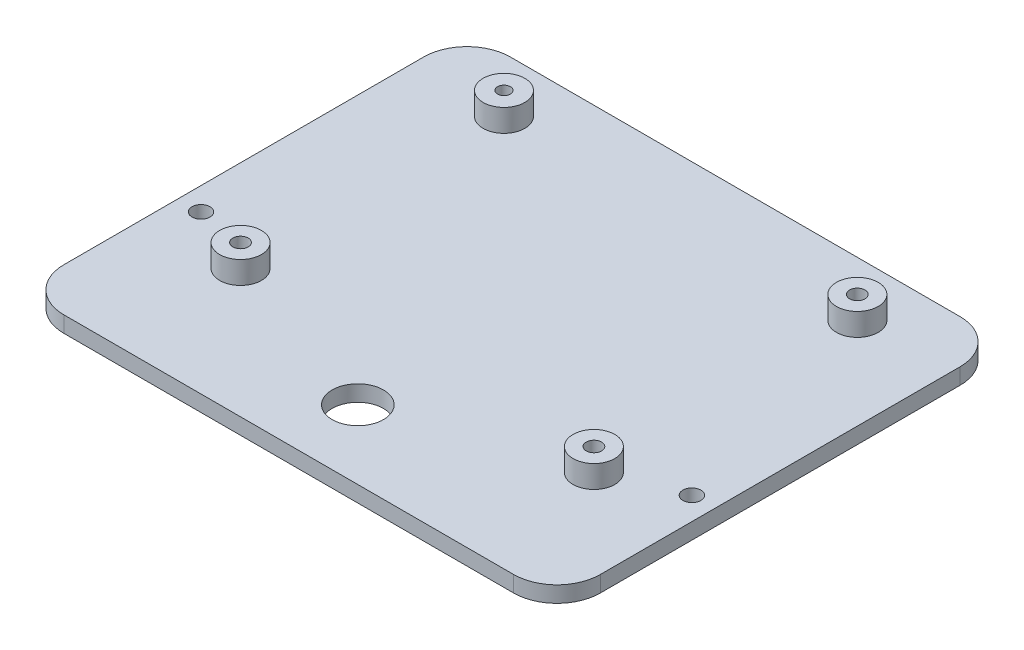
SolidWorks part; units mm, degrees
ref_plane "Front Plane" through (0, 0, 0) normal (0, 0, 1) x (1, 0, 0)
ref_plane "Top Plane" through (0, 0, 0) normal (0, 1, 0) x (1, 0, 0)
ref_plane "Right Plane" through (0, 0, 0) normal (1, 0, 0) x (0, 0, -1)
sketch "Sketch1" plane through (0, 0, 0) normal (0, 1, 0) x (1, 0, 0)
  line L0 (0, 12) -> (0, 13) construction
  line L1 (-32.5, -8.5) -> (32.5, -8.5)
  line L2 (-32.5, -8.5) -> (-32.5, 8.5)
  line L3 (-32.5, 8.5) -> (32.5, 8.5)
  line L4 (32.5, -8.5) -> (32.5, 8.5)
  line L5 (-32.5, -8.5) -> (32.5, 8.5) construction
  line L6 (-32.5, 8.5) -> (32.5, -8.5) construction
  line L15 (0, -12) -> (0, -17.3) construction
  line L21 (-39.5, 18.7) -> (40.5, 18.7)
  line L22 (-39.5, 18.7) -> (-39.5, -17.3)
  line L23 (-39.5, -17.3) -> (40.5, -17.3)
  line L24 (40.5, 18.7) -> (40.5, -17.3)
  line L29 (-36.5, -13) -> (36.5, 13) construction
  line L30 (-36.5, 13) -> (36.5, -13) construction
  point P0 (0, 0)
  point P6 (0, 0)
  point P23 (0, 0)
extrude "Boss-Extrude2" add sketch "Sketch1" along normal blind 2
sketch "Sketch2" plane through (0, 2, 0) normal (0, 1, 0) x (1, 0, 0)
  line L0 (36.5, 0) -> (38, 0) construction
  line L1 (-36.5, -13) -> (36.5, -13)
  line L2 (-36.5, -13) -> (-36.5, 13)
  line L3 (-36.5, 13) -> (36.5, 13)
  line L4 (36.5, -13) -> (36.5, 13)
  line L5 (-36.5, -13) -> (36.5, 13) construction
  line L6 (-36.5, 13) -> (36.5, -13) construction
  line L7 (-38, -14.5) -> (38, -14.5)
  line L8 (-38, -14.5) -> (-38, 14.5)
  line L9 (-38, 14.5) -> (38, 14.5)
  line L10 (38, -14.5) -> (38, 14.5)
  line L11 (-38, -14.5) -> (38, 14.5) construction
  line L12 (-38, 14.5) -> (38, -14.5) construction
  line L13 (0, 13) -> (0, 14.5) construction
  point P0 (0, 0)
  point P6 (0, 0)
extrude "Boss-Extrude3" add sketch "Sketch2" along normal blind 3
sketch "Sketch3" plane through (0, 2, 0) normal (0, 1, 0) x (1, 0, 0)
  circle A0 centre (-37.4, 16.6) radius 1.6
  circle A1 centre (38.4, 16.6) radius 1.6
  circle A2 centre (38.4, -15.2) radius 1.6
  circle A3 centre (-37.4, -15.2) radius 1.6
extrude "Boss-Extrude4" add sketch "Sketch3" along normal blind 0.5 contours A3 M3 M2 | A2 M2 M1 | A1 | A0
sketch "Sketch5" plane through (0, 5, 0) normal (0, 1, 0) x (1, 0, 0)
  line L1 (-38, 14.5) -> (38, 14.5)
  line L2 (-38, 14.5) -> (-38, -14.5)
  line L3 (-38, -14.5) -> (38, -14.5)
  line L4 (38, 14.5) -> (38, -14.5)
  line L5 (-36.5, 13) -> (36.5, 13)
  line L6 (-36.5, 13) -> (-36.5, -13)
  line L7 (-36.5, -13) -> (36.5, -13)
  line L8 (36.5, 13) -> (36.5, -13)
extrude "Boss-Extrude5" add sketch "Sketch5" against normal blind 8
sketch "Sketch7" plane through (0, 2.5, 0) normal (0, 1, 0) x (1, 0, 0)
  circle A0 centre (-37.4, 16.6) radius 1.6
  circle A1 centre (-37.4, -15.2) radius 1.6
  circle A2 centre (38.4, -15.2) radius 1.6
  circle A3 centre (38.4, 16.6) radius 1.6
extrude "Boss-Extrude7" add sketch "Sketch7" against normal blind 3
sketch "Sketch8" plane through (0, 2, 0) normal (0, 1, 0) x (1, 0, 0)
  line L1 (-39.5, 18.7) -> (40.5, 18.7)
  line L2 (-39.5, 18.7) -> (-39.5, -17.3)
  line L3 (-39.5, -17.3) -> (40.5, -17.3)
  line L4 (40.5, 18.7) -> (40.5, -17.3)
extrude "Cut-Extrude3" cut sketch "Sketch8" along normal blind 75
sketch "Sketch9" plane through (0, 2, 0) normal (0, 1, 0) x (1, 0, 0)
  line L0 (-32.5, 8.5) -> (32.5, -8.5) construction
  line L1 (32.5, -8.5) -> (35.5526, -9.2984) construction
  line L2 (-40.5, 0) -> (-42, 0) construction
  line L3 (-40.5, -18.7) -> (40.5, -18.7)
  line L4 (-40.5, -18.7) -> (-40.5, 18.7)
  line L5 (-40.5, 18.7) -> (40.5, 18.7)
  line L6 (40.5, -18.7) -> (40.5, 18.7)
  line L7 (-40.5, -18.7) -> (40.5, 18.7) construction
  line L8 (-40.5, 18.7) -> (40.5, -18.7) construction
  line L9 (40.5, 0) -> (42, 0) construction
  line L10 (0, 18.7) -> (0, 23.7) construction
  line L11 (-42, -11.3) -> (-44.5, -11.3) construction
  line L12 (-42, 23.7) -> (42, 23.7)
  line L13 (-42, 23.7) -> (-42, -46.3)
  line L14 (-42, -46.3) -> (42, -46.3)
  line L15 (42, 23.7) -> (42, -46.3)
  line L16 (42, -11.3) -> (44.5, -11.3) construction
  line L17 (0, 23.7) -> (0, 26.2) construction
  line L18 (0, -46.3) -> (0, -48.8) construction
  line L20 (-44.5, 26.2) -> (44.5, 26.2)
  line L21 (-44.5, 26.2) -> (-44.5, -48.8)
  line L22 (-44.5, -48.8) -> (44.5, -48.8)
  line L23 (44.5, 26.2) -> (44.5, -48.8)
  point P5 (0, 0)
extrude "Boss-Extrude8" add sketch "Sketch9" against normal blind 35 separate body contours L23 L20 L21 L22 L12 L15 L14 L13
fillet "Fillet2" radius 7 4 edges at (-42, -15.5, 46.3) (42, -15.5, 46.3) (42, -15.5, -23.7) (-42, -15.5, -23.7)
fillet "Fillet3" radius 10 4 edges at (-44.5, -15.5, 48.8) (44.5, -15.5, 48.8) (44.5, -15.5, -26.2) (-44.5, -15.5, -26.2)
sketch "Sketch10" plane through (0, 2, 0) normal (0, 1, 0) x (1, 0, 0)
  line L0 (-35, 23.7) -> (35, 23.7)
  line L1 (-42, 16.7) -> (-42, -39.3)
  line L2 (-35, -46.3) -> (35, -46.3)
  line L3 (42, 16.7) -> (42, -39.3)
  line L5 (-32.5, 8.5) -> (32.5, 8.5)
  line L6 (-32.5, 8.5) -> (-32.5, -8.5)
  line L7 (-32.5, -8.5) -> (32.5, -8.5)
  line L8 (32.5, 8.5) -> (32.5, -8.5)
  circle A0 centre (-35, 16.7) radius 7
  circle A1 centre (35, 16.7) radius 7
  circle A2 centre (35, -39.3) radius 7
  circle A3 centre (-35, -39.3) radius 7
extrude "Boss-Extrude10" add sketch "Sketch10" against normal blind 2 contours A3 A2 A1 A0 L5 L8 L7 L6 M16 M14 M12 M10 | A0 M11 | A1 M13 | A2 M15 | A3 M17
sketch "Sketch12" plane through (0, -3, 0) normal (0, -1, 0) x (1, 0, 0)
  line L1 (38, -14.5) -> (-38, -14.5)
  line L2 (38, -14.5) -> (38, 14.5)
  line L3 (38, 14.5) -> (-38, 14.5)
  line L4 (-38, -14.5) -> (-38, 14.5)
extrude "Cut-Extrude4" cut sketch "Sketch12" against normal blind 3
sketch "Sketch13" plane through (0, 0, 0) normal (0, -1, 0) x (-1, 0, 0)
  line L0 (-38.4, 19.6) -> (-41.371, 19.6)
  line L1 (-38.4, 13.6) -> (-42, 13.6)
  line L2 (-42, 16.7) -> (-42, -39.3) construction
  line L3 (37.4, 19.6) -> (41.371, 19.6)
  line L4 (37.4, 13.6) -> (42, 13.6)
  line L5 (42, -39.3) -> (42, 16.7) construction
  line L6 (37.4, -12.2) -> (42, -12.2)
  line L7 (37.4, -18.2) -> (42, -18.2)
  line L8 (-38.4, -12.2) -> (-42, -12.2)
  line L9 (-38.4, -18.2) -> (-42, -18.2)
  circle A0 centre (-38.4, -15.2) radius 1.6
  circle A1 centre (-38.4, 16.6) radius 1.6
  circle A2 centre (37.4, 16.6) radius 1.6
  circle A3 centre (37.4, -15.2) radius 1.6
  circle A4 centre (-38.4, 16.6) radius 3
  circle A5 centre (37.4, 16.6) radius 3
  circle A6 centre (-38.4, -15.2) radius 3
  circle A7 centre (37.4, -15.2) radius 3
  arc A8 (-35, 23.7) -> (-42, 16.7) centre (-35, 16.7) ccw construction
  arc A9 (42, 16.7) -> (35, 23.7) centre (35, 16.7) ccw construction
extrude "Boss-Extrude11" add sketch "Sketch13" along normal blind 6.5 contours A4 M8 | A4 L0 L1 M16 M17 | A5 L4 L3 M13 M14 | A5 M9 | A7 L7 L6 M13 | A7 A3 M6 | A6 A0 M10 | A6 L8 L9 M17
sketch "Sketch14" plane through (0, -6.5, 0) normal (0, -1, 0) x (-1, 0, 0)
  circle A0 centre (-38.4, 16.6) radius 1.6
  circle A1 centre (37.4, 16.6) radius 1.6
  circle A2 centre (37.4, -15.2) radius 1.6
  circle A3 centre (-38.4, -15.2) radius 1.6
extrude "Cut-Extrude5" cut sketch "Sketch14" against normal blind 6.5
sketch "Sketch15" plane through (0, 0, 0) normal (0, -1, 0) x (1, 0, 0)
  line L0 (-37.4, 18.2) -> (38.4, 18.2) construction
  line L1 (20.25, 28.9039) -> (20.25, 46.3) construction
  line L2 (35, 46.3) -> (-35, 46.3) construction
  line L3 (42, 32.25) -> (32, 32.25) construction
  line L4 (42, 18.2) -> (42, 39.3) construction
  line L5 (-42, 32.25) -> (-32, 32.25) construction
  line L6 (-42, 39.3) -> (-42, 18.2) construction
  line L7 (32, 18.2) -> (32, 46.3) construction
  line L8 (-32, 18.2) -> (-32, 46.3) construction
  line L9 (0, 8.5) -> (0, 46.3) construction
  line L10 (-32.5, 8.5) -> (32.5, 8.5) construction
  line L11 (-24.375, 28.9039) -> (-24.375, 46.3) construction
  line L12 (7.75, 28.9039) -> (-16.75, 28.9039) construction
  circle A0 centre (-24.375, 28.9039) radius 7.625
  circle A3 centre (20.25, 28.9039) radius 3.5
  circle A5 centre (-4.5, 28.9039) radius 2.55
sketch "Sketch16" plane through (0, -6.5, 0) normal (0, -1, 0) x (1, 0, 0)
sketch "Sketch17" plane through (0, 2, 0) normal (0, 1, 0) x (1, 0, 0)
extrude "Cut-Extrude6" cut sketch "Sketch15" against normal blind 6.5
sketch "Sketch18" plane through (0, 0, 0) normal (0, -1, 0) x (-1, 0, 0)
  line L0 (37.4, 19.6) -> (-38.4, 19.6)
  line L1 (-35, 23.7) -> (35, 23.7)
  line L2 (-38.4, 19.6) -> (-41.371, 19.6)
  line L3 (37.4, 19.6) -> (41.371, 19.6)
  circle A0 centre (35, 16.7) radius 7
  circle A1 centre (-35, 16.7) radius 7
extrude "Boss-Extrude12" add sketch "Sketch18" along normal blind 30.5 contours L0 A1 M27 M28 | A1 L0 A0 M26 | A0 L0 M25 M24
sketch "Sketch19" plane through (0, 0, 0) normal (0, -1, 0) x (-1, 0, 0)
  line L0 (-38.4, -12.2) -> (-42, -12.2) construction
  line L1 (-42, 13.6) -> (-41, 13.6)
  line L2 (-42, 13.6) -> (-42, -12.2)
  line L3 (-42, -12.2) -> (-41, -12.2)
  line L4 (-41, 13.6) -> (-41, -12.2)
  line L5 (37.4, -12.2) -> (42, -12.2) construction
  line L6 (42, 13.6) -> (41, 13.6)
  line L7 (42, 13.6) -> (42, -12.2)
  line L8 (42, -12.2) -> (41, -12.2)
  line L9 (41, 13.6) -> (41, -12.2)
extrude "Boss-Extrude14" add sketch "Sketch19" along normal blind 30.5
sketch "Sketch20" plane through (0, 0, 0) normal (0, -1, 0) x (-1, 0, 0)
  line L0 (-42, -39.3) -> (42, -39.3)
  line L1 (35, -46.3) -> (-35, -46.3)
  arc A1 (35, -46.3) -> (42, -39.3) centre (35, -39.3) ccw construction
  circle A2 centre (35, -39.3) radius 7
  circle A3 centre (-35, -39.3) radius 7
extrude "Boss-Extrude15" add sketch "Sketch20" along normal blind 30.5 contours L0 A2 M22 | A3 A2 L0 M21 | A3 L0 M20
sketch "Sketch22" plane through (0, 0, 0) normal (0, -1, 0) x (-1, 0, 0)
  line L0 (-42, -39.3) -> (42, -39.3) construction
  line L1 (-42, -18.2) -> (-41, -18.2)
  line L2 (-42, -18.2) -> (-42, -39.3)
  line L3 (-42, -39.3) -> (-41, -39.3)
  line L4 (-41, -18.2) -> (-41, -39.3)
  line L5 (37.4, -18.2) -> (42, -18.2) construction
  line L6 (42, -39.3) -> (41, -39.3)
  line L7 (42, -39.3) -> (42, -18.2)
  line L8 (42, -18.2) -> (41, -18.2)
  line L9 (41, -39.3) -> (41, -18.2)
extrude "Boss-Extrude16" add sketch "Sketch22" along normal blind 30.5
sketch "Sketch23" plane through (0, -30.5, 0) normal (0, -1, 0) x (-1, 0, 0)
  line L1 (-41, -12.2) -> (-42, -12.2)
  line L2 (-41, -12.2) -> (-41, -18.2)
  line L3 (-41, -18.2) -> (-42, -18.2)
  line L4 (-42, -12.2) -> (-42, -18.2)
  line L5 (42, -12.2) -> (41, -12.2)
  line L6 (42, -12.2) -> (42, -18.2)
  line L7 (42, -18.2) -> (41, -18.2)
  line L8 (41, -12.2) -> (41, -18.2)
extrude "Boss-Extrude17" add sketch "Sketch23" against normal blind 24.5 contours L6 L5 L8 L7
sketch "Sketch24" plane through (0, -30.5, 0) normal (0, -1, 0) x (-1, 0, 0)
  line L0 (41, 13.6) -> (41, 19.6)
  line L1 (41.371, 19.6) -> (-41.371, 19.6) construction
  line L2 (-41, 13.6) -> (-41, 19.6)
  line L4 (-41, 19.6) -> (-42, 19.6)
  line L5 (-41, 19.6) -> (-41, 13.6)
  line L6 (-41, 13.6) -> (-42, 13.6)
  line L7 (-42, 19.6) -> (-42, 13.6)
  line L8 (42, 13.6) -> (41, 13.6)
  line L9 (42, 13.6) -> (42, 19.6)
  line L10 (42, 19.6) -> (41, 19.6)
  line L11 (41, 13.6) -> (41, 19.6)
extrude "Boss-Extrude18" add sketch "Sketch24" against normal blind 26.5 contours L9 L10 L0 M2 | L4 L7 L6 L2
sketch "Sketch25" plane through (0, -30.5, 0) normal (0, -1, 0) x (-1, 0, 0)
  line L1 (-41, -12.2) -> (-42, -12.2)
  line L2 (-41, -12.2) -> (-41, -18.2)
  line L3 (-41, -18.2) -> (-42, -18.2)
  line L4 (-42, -12.2) -> (-42, -18.2)
extrude "Boss-Extrude19" add sketch "Sketch25" against normal blind 24.5
sketch "Sketch27" plane through (0, -30.5, 0) normal (0, -1, 0) x (-1, 0, 0)
  line L0 (0, -46.3) -> (0, -42.2) construction
  line L1 (-35, -46.3) -> (35, -46.3) construction
  line L2 (41.371, -42.2) -> (-41.371, -42.2)
  arc A0 (35, -46.3) -> (42, -39.3) centre (35, -39.3) ccw construction
  arc A1 (-42, -39.3) -> (-35, -46.3) centre (-35, -39.3) ccw construction
  circle A2 centre (35, -39.3) radius 7
  circle A3 centre (35, -39.3) radius 6
  circle A4 centre (-35, -39.3) radius 7
  circle A5 centre (-35, -39.3) radius 6
extrude "Cut-Extrude7" cut sketch "Sketch27" against normal blind 30.5 contours A4 L2 A2 M2 | A5 L2 A4 M2 | A5 L2 M2 | A3 L2 M2 | A3 A2 L2 M2
sketch "Sketch28" plane through (0, -30.5, 0) normal (0, -1, 0) x (-1, 0, 0)
  line L0 (-41, 16.7) -> (-41, 19.6)
  line L1 (-41, 19.6) -> (-40.2526, 19.6)
  line L2 (41, 19.6) -> (-41, 19.6) construction
  line L3 (41, 16.7) -> (41, 19.6)
  line L4 (41, 19.6) -> (27.1652, 19.6)
  circle A0 centre (-35, 16.7) radius 7
  circle A1 centre (-35, 16.7) radius 6
  circle A2 centre (35, 16.7) radius 7
  circle A3 centre (35.2573, 16.7) radius 5.7427
extrude "Boss-Extrude20" add sketch "Sketch28" against normal blind 30.5 contours A1 M6 M5 | A3 L4 M7
sketch "Sketch29" plane through (0, 0, 0) normal (0, -1, 0) x (-1, 0, 0)
  line L0 (34.4, -15.2) -> (34.4, -25.2) construction
  line L2 (41, -18.2) -> (34.4, -18.2)
  line L3 (41, -18.2) -> (41, -24.8)
  line L4 (41, -24.8) -> (34.4, -24.8)
  line L5 (34.4, -18.2) -> (34.4, -24.8)
  line L7 (-41, -18.2) -> (-35.4, -18.2)
  line L8 (-41, -18.2) -> (-41, -24.8)
  line L9 (-41, -24.8) -> (-35.4, -24.8)
  line L10 (-35.4, -18.2) -> (-35.4, -24.8)
  arc A0 (37.4, -12.2) -> (37.4, -18.2) centre (37.4, -15.2) ccw construction
extrude "Boss-Extrude21" add sketch "Sketch29" along normal blind 30.5
sketch "Sketch30" plane through (0, 0, 0) normal (0, -1, 0) x (-1, 0, 0)
  line L0 (-38.4, -18.2) -> (-35.4, -18.2)
  line L1 (-35.4, -18.2) -> (-38.4, -18.2) construction
  line L2 (-35.4, -18.2) -> (-35.4, -15.2)
  line L3 (34.4, -18.2) -> (34.4, -15.2)
  line L4 (34.4, -18.2) -> (37.4, -18.2)
  line L5 (37.4, -18.2) -> (34.4, -18.2) construction
  arc A0 (-38.4, -18.2) -> (-38.4, -12.2) centre (-38.4, -15.2) ccw construction
  circle A1 centre (-38.4, -15.2) radius 3
  arc A2 (37.4, -12.2) -> (37.4, -18.2) centre (37.4, -15.2) ccw construction
  circle A3 centre (37.4, -15.2) radius 3
extrude "Boss-Extrude22" add sketch "Sketch30" along normal blind 6.5 contours L3 M16 M17 | L2 M28 M27
sketch "Sketch31" plane through (0, -30.5, 0) normal (0, -1, 0) x (-1, 0, 0)
  line L0 (41, -24.8) -> (41, -18.2) construction
  line L1 (-41, -24.8) -> (-41, -18.2) construction
  line L2 (-41, -21.5) -> (-35.4, -21.5) construction
  line L3 (-35.4, -24.8) -> (-35.4, -18.2) construction
  line L4 (41, -21.5) -> (38.2, -21.5) construction
  circle A0 centre (-38.2, -21.5) radius 1.4
  circle A1 centre (38.2, -21.5) radius 1.4
extrude "Cut-Extrude8" cut sketch "Sketch31" against normal blind 15
sketch "Sketch32" plane through (0, 0, 0) normal (0, -1, 0) x (-1, 0, 0)
  line L0 (24.375, -21.2789) -> (24.375, -18.7789) construction
  circle A0 centre (24.375, -28.9039) radius 7.625
  circle A1 centre (24.375, -28.9039) radius 10.125
extrude "Boss-Extrude23" add sketch "Sketch32" along normal blind 3
sketch "Sketch33" plane through (0, 0, 0) normal (0, -1, 0) x (-1, 0, 0)
  line L0 (7.05, -28.9039) -> (9.05, -28.9039) construction
  circle A0 centre (4.5, -28.9039) radius 2.55
  circle A1 centre (4.5, -28.9039) radius 4.55
extrude "Boss-Extrude24" add sketch "Sketch33" along normal blind 4.5
sketch "Sketch37" plane through (0, -30.5, 0) normal (0, -1, 0) x (-1, 0, 0)
  circle A0 centre (38.2, -21.5) radius 1.4
  circle A1 centre (-38.2, -21.5) radius 1.4
extrude "Boss-Extrude25" add sketch "Sketch37" along normal blind 31.5 separate body
sketch "Sketch38" plane through (0, -33, 0) normal (0, -1, 0) x (-1, 0, 0)
  line L0 (-35, 23.7) -> (35, 23.7)
  line L1 (42, 16.7) -> (42, -39.3)
  line L2 (-42, 16.7) -> (-42, -39.3)
  line L3 (35, -46.3) -> (-35, -46.3)
  circle A0 centre (35, 16.7) radius 7
  circle A1 centre (35, -39.3) radius 7
  circle A2 centre (-35, -39.3) radius 7
  circle A3 centre (-35, 16.7) radius 7
extrude "Boss-Extrude26" add sketch "Sketch38" along normal blind 2.5 contours A3 A2 A1 A0 M16 M14 M12 M10 | A3 M17 | A0 M11 | A1 M13 | A2 M15
sketch "Sketch39" plane through (0, 2, 0) normal (0, 1, 0) x (1, 0, 0)
  line L1 (-66.5334, -66.4888) -> (66.5334, -66.4888)
  line L2 (-66.5334, -66.4888) -> (-66.5334, 66.4888)
  line L3 (-66.5334, 66.4888) -> (66.5334, 66.4888)
  line L4 (66.5334, -66.4888) -> (66.5334, 66.4888)
  line L5 (-66.5334, -66.4888) -> (66.5334, 66.4888) construction
  line L6 (-66.5334, 66.4888) -> (66.5334, -66.4888) construction
  point P0 (0, 0)
extrude "Cut-Extrude11" cut sketch "Sketch39" against normal blind 35
sketch "Sketch40" plane through (0, -62, 0) normal (0, -1, 0) x (-1, 0, 0)
  circle A0 centre (-38.2, -21.5) radius 1.4
  circle A1 centre (38.2, -21.5) radius 1.4
extrude "Cut-Extrude12" cut sketch "Sketch40" against normal blind 35
sketch "Sketch41" plane through (0, -35.5, 0) normal (0, -1, 0) x (1, 0, 0)
  line L0 (39.9497, -21.6497) -> (-39.9497, 44.2497) construction
  line L1 (0, -23.45) -> (0, -23.7) construction
  line L2 (41.75, 46.05) -> (-41.75, 46.05)
  line L3 (41.75, 46.05) -> (41.75, -23.45)
  line L4 (41.75, -23.45) -> (-41.75, -23.45)
  line L5 (-41.75, 46.05) -> (-41.75, -23.45)
  line L6 (41.75, 46.05) -> (-41.75, -23.45) construction
  line L7 (41.75, -23.45) -> (-41.75, 46.05) construction
  line L8 (35, -23.7) -> (-35, -23.7) construction
  line L9 (-41.75, 11.3) -> (-42, 11.3) construction
  line L10 (-42, -16.7) -> (-42, 39.3) construction
  line L12 (49.8162, 56.1432) -> (-48.2943, 56.1432)
  line L13 (49.8162, 56.1432) -> (49.8162, -34.7984)
  line L14 (49.8162, -34.7984) -> (-48.2943, -34.7984)
  line L15 (-48.2943, 56.1432) -> (-48.2943, -34.7984)
  line L16 (49.8162, 56.1432) -> (-48.2943, -34.7984) construction
  line L17 (49.8162, -34.7984) -> (-48.2943, 56.1432) construction
  arc A0 (35, -23.7) -> (42, -16.7) centre (35, -16.7) ccw construction
  arc A1 (-35, 46.3) -> (-42, 39.3) centre (-35, 39.3) ccw construction
  circle A2 centre (-35, -16.7) radius 6.75
  circle A3 centre (35, -16.7) radius 6.75
  circle A4 centre (35, 39.3) radius 6.75
  circle A5 centre (-35, 39.3) radius 6.75
  point P8 (0, 11.3)
  point P33 (0.761, 10.6724)
extrude "Cut-Extrude13" cut sketch "Sketch41" against normal blind 35 contours L4 M10 M16 M9 | A3 L4 L3 M10 | L3 M12 M10 M11 | A4 L3 L2 M12 | L2 M12 M13 M14 | A5 L2 L5 M14 | L5 M14 M15 M16 | A2 L5 L4 M16
sketch "Sketch42" plane through (0, -33, 0) normal (0, 1, 0) x (1, 0, 0)
  line L12 (-31, -29.55) -> (31, 18.45) construction
  line L13 (-31, 18.45) -> (31, -29.55) construction
  line L14 (0, -46.05) -> (0, -41.05) construction
  line L15 (35, -46.05) -> (-35, -46.05) construction
  line L16 (0, -41.05) -> (0, -29.55) construction
  line L19 (-27.5, -26.05) -> (27.5, 14.95) construction
  line L20 (-27.5, 14.95) -> (27.5, -26.05) construction
  circle A0 centre (0, -35.3) radius 4
  circle A1 centre (-27.5, 14.95) radius 1
  circle A2 centre (27.5, 14.95) radius 1.2
  circle A3 centre (-27.5, -26.05) radius 1.2
  circle A4 centre (27.5, -26.05) radius 1.2
  point P0 (0, -5.55)
  point P6 (0, -11.3)
extrude "Cut-Extrude14" cut sketch "Sketch42" against normal blind 10
sketch "Sketch43" plane through (0, -33, 0) normal (0, 1, 0) x (1, 0, 0)
  circle A0 centre (-27.5, 14.95) radius 3.25
  circle A1 centre (27.5, 14.95) radius 3.25
  circle A2 centre (27.5, -26.05) radius 3.25
  circle A3 centre (-27.5, -26.05) radius 3.25
  circle A4 centre (-27.5, -26.05) radius 1.2
  circle A5 centre (27.5, -26.05) radius 1.2
  circle A6 centre (-27.5, 14.95) radius 1
  circle A7 centre (27.5, 14.95) radius 1.2
extrude "Boss-Extrude28" add sketch "Sketch43" along normal blind 3.5
sketch "Sketch45" plane through (0, -35.5, 0) normal (0, -1, 0) x (-1, 0, 0)
  line L1 (-33.6339, -31.4224) -> (-20.7815, -31.4224)
  line L2 (-33.6339, -31.4224) -> (-33.6339, 18.3704)
  line L3 (-33.6339, 18.3704) -> (-20.7815, 18.3704)
  line L4 (-20.7815, -31.4224) -> (-20.7815, 18.3704)
  line L5 (32.1317, 16.8202) -> (22.1801, 16.8202)
  line L6 (32.1317, 16.8202) -> (32.1317, -31.4224)
  line L7 (32.1317, -31.4224) -> (22.1801, -31.4224)
  line L8 (22.1801, 16.8202) -> (22.1801, -31.4224)
extrude "Boss-Extrude29" add sketch "Sketch45" against normal blind 1
